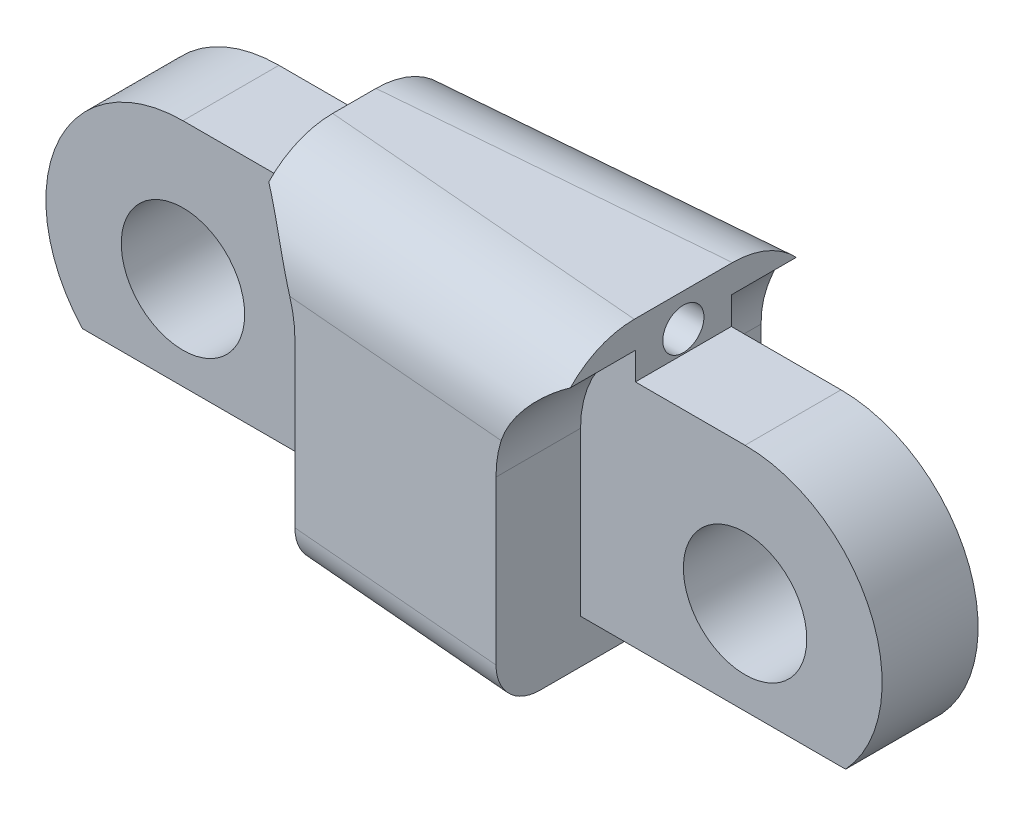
SolidWorks part; units mm, degrees
ref_plane "Front Plane" through (0, 0, 0) normal (0, 0, 1) x (1, 0, 0)
ref_plane "Top Plane" through (0, 0, 0) normal (0, 1, 0) x (1, 0, 0)
ref_plane "Right Plane" through (0, 0, 0) normal (1, 0, 0) x (0, 0, -1)
sketch "Sketch1" plane through (0, 0, 0) normal (0, 1, 0) x (1, 0, 0)
  line L0 (0, -6.35) -> (0, 6.35)
  line L1 (0, 6.35) -> (19.05, 7.9375)
  line L2 (19.05, 7.9375) -> (19.05, -7.9375)
  line L3 (0, 0) -> (36.2603, 0) construction
  line L4 (0, -6.35) -> (19.05, -7.9375)
  point P8 (19.05, 0)
  dimension "D1" = 12.7
  dimension "D2" = 15.875
  dimension "D3" = 19.05
extrude "Boss-Extrude1" add sketch "Sketch1" along normal blind 19.05
fillet "Fillet1" radius 5.08 2 edges at (9.525, 19.05, -7.1437) (9.525, 19.05, 7.1437)
sketch "Sketch2" plane through (19.05, 0, 0) normal (1, 0, 0) x (0, 0, -1)
  line L0 (-7.9375, 0) -> (7.9375, 0) construction
  line L1 (-2.7781, 15.875) -> (2.7781, 15.875)
  line L2 (-2.7781, 15.875) -> (-2.7781, 0)
  line L3 (-2.7781, 0) -> (2.7781, 0)
  line L4 (2.7781, 15.875) -> (2.7781, 0)
  line L6 (0, 0) -> (0, 14.414) construction
  point P11 (0, 15.875)
  dimension "D1" = 5.5562
  dimension "D2" = 15.875
extrude "Boss-Extrude2" add sketch "Sketch2" along normal blind 6.35
sketch "Sketch3" plane through (0, 0, 0) normal (-1, 0, 0) x (0, 0, 1)
  line L0 (-6.35, 0) -> (6.35, 0) construction
  line L1 (-2.7781, 0) -> (2.7781, 0)
  line L2 (-2.7781, 0) -> (-2.7781, 15.875)
  line L3 (-2.7781, 15.875) -> (2.7781, 15.875)
  line L4 (2.7781, 0) -> (2.7781, 15.875)
  line L5 (0, 0) -> (0, 15.4035) construction
  point P9 (0, 15.875)
  dimension "D1" = 15.875
  dimension "D2" = 5.5562
extrude "Boss-Extrude3" add sketch "Sketch3" along normal blind 7.1437
sketch "Sketch4" plane through (25.4, 0, 0) normal (1, 0, 0) x (0, 0, -1)
  line L0 (2.7781, 0) -> (2.7781, 15.875) construction
  line L1 (-2.7781, 0) -> (2.7781, 0)
  line L2 (-2.7781, 0) -> (-2.7781, 7.9375)
  line L3 (-2.7781, 7.9375) -> (2.7781, 7.9375)
  line L4 (2.7781, 0) -> (2.7781, 7.9375)
revolve "Revolve1" add sketch "Sketch4" angle 180 about L3
sketch "Sketch5" plane through (-7.1437, 0, 0) normal (-1, 0, 0) x (0, 0, 1)
  line L0 (2.7781, 0) -> (2.7781, 15.875) construction
  line L1 (-2.7781, 0) -> (2.7781, 0)
  line L2 (-2.7781, 0) -> (-2.7781, 7.9375)
  line L3 (-2.7781, 7.9375) -> (2.7781, 7.9375)
  line L4 (2.7781, 0) -> (2.7781, 7.9375)
revolve "Revolve2" add sketch "Sketch5" angle 180 about L3
sketch "Sketch6" plane through (0, 0, 2.7781) normal (0, 0, 1) x (1, 0, 0)
  circle A0 centre (25.4, 7.9375) radius 3.5719
  circle A1 centre (-7.1437, 7.9375) radius 3.5719
  dimension "D1" = 7.1437
  dimension "D2" = 7.1437
extrude "Cut-Extrude1" cut sketch "Sketch6" against normal through all
fillet "Fillet2" radius 2.54 2 edges at (9.525, 0, -7.1437) (9.525, 0, 7.1437)
ref_plane "Plane1" through (0, 0, 2.7781) normal (0, 0, 1) x (1, 0, 0)
sketch "Sketch7" plane through (0, 0, 2.7781) normal (0, 0, 1) x (1, 0, 0)
  line L0 (15.875, 0) -> (15.875, 11.9632)
  line L1 (19.05, 0) -> (0, 0) construction
  line L2 (19.05, 17.4625) -> (19.05, 0)
  line L3 (19.05, 0) -> (15.875, 0)
  line L4 (19.05, 13.97) -> (19.05, 19.05) construction
  line L5 (25.4, 15.875) -> (19.05, 15.875) construction
  arc A0 (15.875, 11.9632) -> (19.05, 17.4625) centre (22.225, 11.9632) cw
  dimension "D2" = 6.35
  dimension "D1" = 3.175
  dimension "D3" = 1.5875
extrude "Cut-Extrude2" cut sketch "Sketch7" along normal through all
mirror "Mirror1" about plane through (0, 0, 0) normal (0, 0, 1) of "Cut-Extrude2"
ref_plane "Plane2" through (9.525, 0, 0) normal (1, 0, 0) x (0, 0, -1)
mirror "Mirror2" about plane through (9.525, 0, 0) normal (1, 0, 0) of "Mirror1", "Cut-Extrude2"
sketch "Sketch8" plane through (19.05, 0, 0) normal (1, 0, 0) x (0, 0, -1)
  line L0 (-2.8399, 19.05) -> (2.8399, 19.05) construction
  line L1 (0, 19.05) -> (0, 15.875) construction
  line L2 (2.7781, 15.875) -> (-2.7781, 15.875) construction
  circle A0 centre (0, 17.145) radius 1.1906
  dimension "D1" = 1.905
  dimension "1/8" = 2.3812
extrude "Cut-Extrude3" cut sketch "Sketch8" against normal up to surface (19.05 mm away)
sketch "Sketch9" plane through (0, 0, 2.7781) normal (0, 0, 1) x (1, 0, 0)
  line L1 (15.875, 0) -> (33.3375, 0)
  line L2 (15.875, 0) -> (15.875, 2.54)
  line L3 (15.875, 2.54) -> (33.3375, 2.54)
  line L4 (33.3375, 0) -> (33.3375, 2.54)
  arc A0 (25.4, 0) -> (25.4, 15.875) centre (25.4, 7.9375) ccw construction
  point P5 (33.3375, 1.27)
  point P9 (33.3375, 7.9375)
  dimension "D1" = 2.54
extrude "Cut-Extrude4" cut sketch "Sketch9" against normal blind 6.35
mirror "Mirror3" about plane through (9.525, 0, 0) normal (1, 0, 0) of "Cut-Extrude4"
sketch "Sketch10" plane through (15.875, 0, 0) normal (1, 0, 0) x (0, 0, -1)
  circle A0 centre (0, 1.778) radius 1.1906
  dimension "D1" = 2.3812
  dimension "D2" = 1.778
extrude "Cut-Extrude6" cut sketch "Sketch10" against normal up to surface (12.7 mm away)
